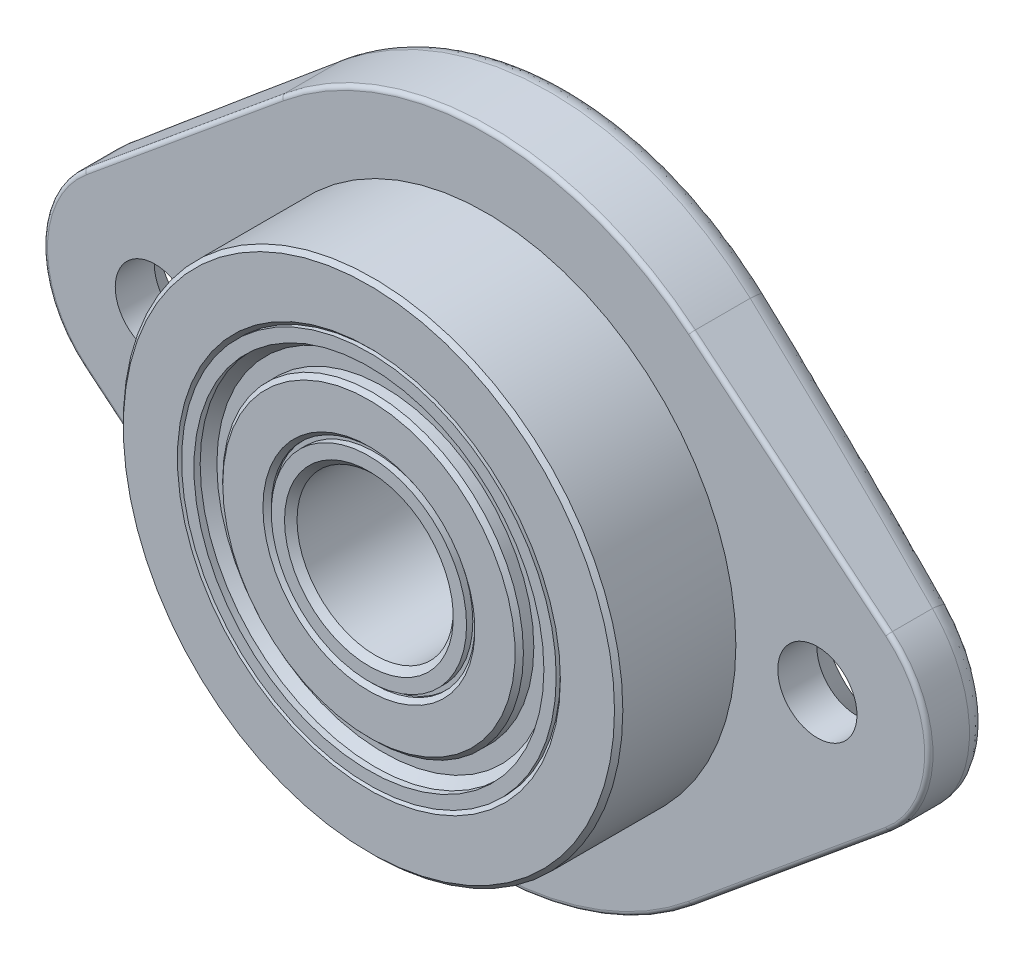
SolidWorks part; units mm, degrees
ref_plane "Front Plane" through (0, 0, 0) normal (0, 0, 1) x (1, 0, 0)
ref_plane "Top Plane" through (0, 0, 0) normal (0, 1, 0) x (1, 0, 0)
ref_plane "Right Plane" through (0, 0, 0) normal (1, 0, 0) x (0, 0, -1)
sketch "Sketch1" plane through (0, 0, 0) normal (0, 0, 1) x (1, 0, 0)
  line L0 (-26.9875, 0) -> (26.9875, 0) construction
  line L1 (0, 0) -> (0, 19.6453) construction
  line L2 (24.517, 5.241) -> (12.5023, 15.1536)
  line L3 (24.517, -5.241) -> (12.5023, -15.1536)
  line L4 (-20.193, 0) -> (20.193, 0) construction
  line L5 (-24.517, 5.241) -> (-12.5023, 15.1536)
  line L6 (-24.517, -5.241) -> (-12.5023, -15.1536)
  line L7 (-17.78, 0) -> (-15.2251, 0) construction
  circle A0 centre (0, 0) radius 4.7625
  circle A1 centre (-20.193, 0) radius 2.413
  circle A2 centre (20.193, 0) radius 2.413
  arc A3 (-24.517, 5.241) -> (-24.517, -5.241) centre (-20.193, 0) ccw
  arc A4 (24.517, 5.241) -> (24.517, -5.241) centre (20.193, 0) cw
  circle A5 centre (0, 0) radius 19.6453
  circle A6 centre (0, 0) radius 15.2251
  circle A7 centre (0, 0) radius 5.9531
  circle A8 centre (0, 0) radius 11.4188
  point P26 (0, 4.7625)
  point P27 (0, 11.4188)
  point P28 (0, 5.9531)
sketch "Sketch3" plane through (0, 0, 0) normal (1, 0, 0) x (0, 0, -1)
  line L0 (-6.1516, 5.9531) -> (-5.7706, 5.9531)
  line L1 (-6.1516, 11.4188) -> (0.9922, 11.4188)
  line L2 (-6.1516, 11.4188) -> (-6.1516, 10.6677)
  line L3 (-6.1516, 4.7625) -> (0.9922, 4.7625)
  line L5 (-5.7706, 5.9531) -> (-5.7706, 6.2071)
  line L6 (-5.7706, 6.2071) -> (-6.1516, 6.2071)
  line L7 (-6.1516, 9.1655) -> (-5.2626, 9.1655)
  line L8 (-5.2626, 9.1655) -> (-5.2626, 10.6677)
  line L9 (-5.2626, 10.6677) -> (-6.1516, 10.6677)
  line L10 (-6.1516, 5.9531) -> (-6.1516, 4.7625)
  line L11 (-6.1516, 9.1655) -> (-6.1516, 6.2071)
  line L12 (0.9922, 11.4188) -> (0.9922, 4.7625)
  line L23 (-6.1516, 0) -> (6.1516, 0) construction
  point P14 (0.9922, 0)
revolve "Revolve1" add sketch "Sketch3" angle 360 about L23
chamfer "Chamfer2" distance 0.381 angle 45 1 edges at (4.7625, 0, 6.1516)
chamfer "Chamfer3" distance 0.254 angle 45 2 edges at (9.1655, 0, 6.1516) (6.2071, 0, 6.1516)
chamfer "Chamfer4" distance 0.508 angle 45 1 edges at (10.6677, 0, 5.2626)
sketch "Sketch2" plane through (0, 0, 0) normal (0, 0, 1) x (1, 0, 0)
  line L0 (24.517, 5.241) -> (12.5023, 15.1536) construction
  line L1 (24.517, -5.241) -> (12.5023, -15.1536) construction
  line L2 (-24.517, -5.241) -> (-12.5023, -15.1536) construction
  line L3 (-24.517, 5.241) -> (-12.5023, 15.1536) construction
  line L4 (24.517, 5.241) -> (12.5023, 15.1536)
  line L5 (24.517, -5.241) -> (12.5023, -15.1536)
  line L6 (-24.517, -5.241) -> (-12.5023, -15.1536)
  line L7 (-24.517, 5.241) -> (-12.5023, 15.1536)
  arc A0 (24.517, -5.241) -> (24.517, 5.241) centre (20.193, 0) ccw construction
  arc A1 (-24.517, 5.241) -> (-24.517, -5.241) centre (-20.193, 0) ccw construction
  circle A2 centre (0, 0) radius 19.6453 construction
  arc A3 (24.517, -5.241) -> (24.517, 5.241) centre (20.193, 0) ccw
  arc A4 (-24.517, 5.241) -> (-24.517, -5.241) centre (-20.193, 0) ccw
  arc A5 (12.5023, 15.1536) -> (-12.5023, 15.1536) centre (0, 0) ccw
  arc A6 (-12.5023, -15.1536) -> (12.5023, -15.1536) centre (0, 0) ccw
  circle A7 centre (20.193, 0) radius 2.413 construction
  circle A8 centre (-20.193, 0) radius 2.413 construction
  circle A9 centre (20.193, 0) radius 2.413
  circle A10 centre (-20.193, 0) radius 2.413
extrude "Extrude1" add sketch "Sketch2" along normal blind 5.1594 from vertex at -6.1516 separate body
sketch "Sketch9" plane through (0, 0, -0.9922) normal (0, 0, 1) x (1, 0, 0)
  circle A0 centre (0, 0) radius 15.2251 construction
  circle A1 centre (0, 0) radius 11.4188 construction
  circle A2 centre (0, 0) radius 15.2251
  circle A3 centre (0, 0) radius 11.4188
extrude "Boss-Extrude2" add sketch "Sketch9" along normal up to vertex (7.1437 mm away)
chamfer "Chamfer5" distance 0.254 angle 45 2 edges at (15.2251, 0, 6.1516) (11.4188, 0, 6.1516)
sketch "Sketch10" plane through (0, 0, -6.1516) normal (0, 0, -1) x (-1, 0, 0)
  circle A0 centre (-20.193, 0) radius 4.826
  circle A1 centre (20.193, 0) radius 4.826
extrude "Cut-Extrude2" cut sketch "Sketch10" against normal through all draft 41
sketch "Sketch5" plane through (0, 0, 0) normal (0, 1, 0) x (1, 0, 0)
  line L0 (12.5023, 6.1516) -> (-12.5023, 6.1516) construction
  line L2 (-26.9875, 4.6037) -> (-26.9875, 6.6596)
  line L3 (-26.9875, 6.6596) -> (26.9875, 6.6596)
  line L4 (26.9875, 4.6037) -> (26.9875, 6.6596)
  line L7 (-12.5023, 6.1516) -> (-24.517, 6.1516) construction
  line L8 (26.9875, 6.1516) -> (24.517, 6.1516) construction
  arc A0 (-26.9875, 4.6037) -> (26.9875, 4.6037) centre (0, -229.898) cw
extrude "Cut-Extrude1" cut sketch "Sketch5" against normal through all both and the other way through all
fillet "Fillet2" radius 1.27 8 edges at (-18.5157, 10.1923, -5.4243) (0.307, 19.6429, -6.1514) (18.5157, 10.1923, -5.4243) (26.9305, 0.8783, -4.6103) (18.5157, -10.1923, -5.4243) (-0.307, -19.6429, -6.1514) (-18.5157, -10.1923, -5.4243) (-26.9305, -0.8783, -4.6103)
fillet "Fillet3" radius 0.254 8 edges at (18.5096, 10.1973, -0.9922) (26.9875, 0, -0.9922) (18.5096, -10.1973, -0.9922) (0, -19.6453, -0.9922) (-18.5096, -10.1973, -0.9922) (-26.9875, 0, -0.9922) (-18.5096, 10.1973, -0.9922) (0, 19.6453, -0.9922)
equation "\"D8@Sketch1\"=\"shaft dia@Sketch1\"*1.25"
equation "\"D4@Sketch3\"=\"D3@Sketch3\"/2.25"
equation "\"D1@Sketch5\" = \"G@Extrude1\"*.3"
equation "\"D7@Sketch3\"= \"D6@Sketch3\" / 3"
equation "\"D1@Sketch10\"=\"F@Sketch1\"*2"
equation "\"D2@Sketch1\"=\"D@Sketch1\"*.775"
equation "\"D10@Sketch1\"=\"D2@Sketch1\"*.75"
